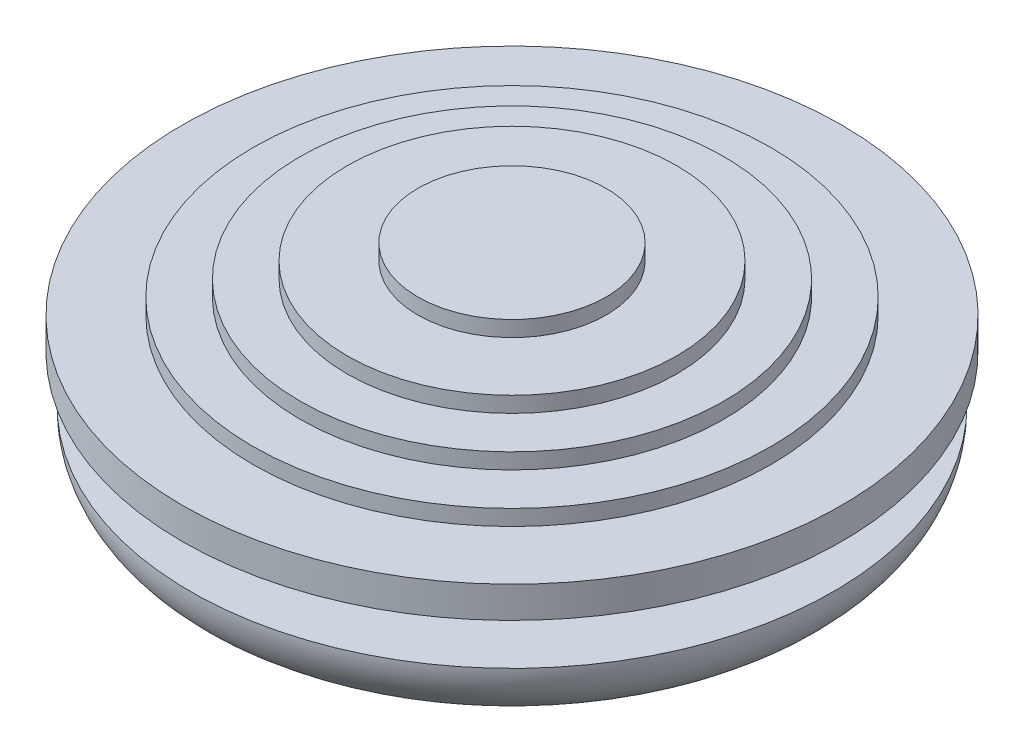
SolidWorks part; units mm, degrees
ref_plane "Front Plane" through (0, 0, 0) normal (0, 0, 1) x (1, 0, 0)
ref_plane "Top Plane" through (0, 0, 0) normal (0, 1, 0) x (1, 0, 0)
ref_plane "Right Plane" through (0, 0, 0) normal (1, 0, 0) x (0, 0, -1)
sketch "Sketch1" plane through (0, 0, 0) normal (0, 1, 0) x (1, 0, 0)
  circle A0 centre (0, 0) radius 21
  dimension "D1" = 42
extrude "Boss-Extrude1" add sketch "Sketch1" along normal blind 2
sketch "Sketch2" plane through (0, 2, 0) normal (0, 1, 0) x (1, 0, 0)
  circle A0 centre (0, 0) radius 16.5
  dimension "D1" = 33
extrude "Cut-Extrude1" cut sketch "Sketch2" against normal blind 2
sketch "Sketch3" plane through (0, 2, 0) normal (0, 1, 0) x (1, 0, 0)
  circle A0 centre (0, 0) radius 16.5 construction
  circle A1 centre (0, 0) radius 16.5
extrude "Boss-Extrude2" add sketch "Sketch3" along normal blind 1 separate body
sketch "Sketch4" plane through (0, 3, 0) normal (0, 1, 0) x (1, 0, 0)
  circle A0 centre (0, 0) radius 13.5
  dimension "D1" = 27
extrude "Cut-Extrude2" cut sketch "Sketch4" against normal blind 2
sketch "Sketch5" plane through (0, 3, 0) normal (0, 1, 0) x (1, 0, 0)
  circle A0 centre (0, 0) radius 13.5 construction
  circle A1 centre (0, 0) radius 13.5
extrude "Boss-Extrude3" add sketch "Sketch5" along normal blind 1 separate body
sketch "Sketch6" plane through (0, 4, 0) normal (0, 1, 0) x (1, 0, 0)
  circle A0 centre (0, 0) radius 10.5
  dimension "D1" = 21
extrude "Cut-Extrude3" cut sketch "Sketch6" against normal blind 2
sketch "Sketch7" plane through (0, 4, 0) normal (0, 1, 0) x (1, 0, 0)
  circle A0 centre (0, 0) radius 10.5 construction
  circle A1 centre (0, 0) radius 10.5
extrude "Boss-Extrude4" add sketch "Sketch7" along normal blind 1 separate body
sketch "Sketch8" plane through (0, 5, 0) normal (0, 1, 0) x (1, 0, 0)
  circle A0 centre (0, 0) radius 6
  dimension "D1" = 12
extrude "Cut-Extrude4" cut sketch "Sketch8" against normal blind 2
sketch "Sketch9" plane through (0, 5, 0) normal (0, 1, 0) x (1, 0, 0)
  circle A0 centre (0, 0) radius 6 construction
  circle A1 centre (0, 0) radius 6
extrude "Boss-Extrude5" add sketch "Sketch9" along normal blind 1 separate body
sketch "Sketch10" plane through (0, 0, 0) normal (0, -1, 0) x (1, 0, 0)
  circle A0 centre (0, 0) radius 16.5
  circle A1 centre (0, 0) radius 15.5
  dimension "D1" = 1
  dimension "D2" = 33
extrude "Boss-Extrude6" add sketch "Sketch10" along normal blind 3 separate body
sketch "Sketch11" plane through (0, -3, 0) normal (0, -1, 0) x (1, 0, 0)
  circle A0 centre (0, 0) radius 16.5 construction
  circle A1 centre (0, 0) radius 16.5
  circle A2 centre (0, 0) radius 20.5
  dimension "D1" = 4
extrude "Boss-Extrude7" add sketch "Sketch11" along normal blind 4 separate body
fillet "Fillet1" radius 4 1 edges at (0, -7, -20.5)
